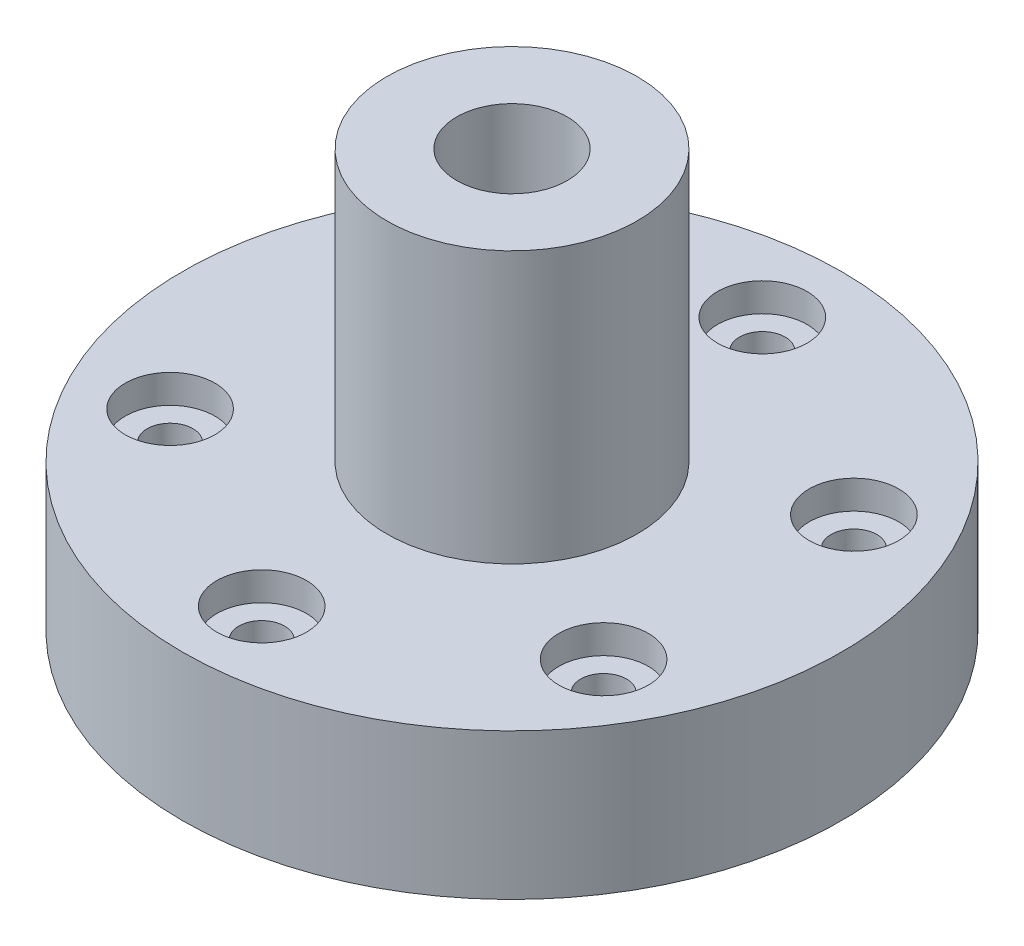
SolidWorks part; units mm, degrees
ref_plane "Front Plane" through (0, 0, 0) normal (0, 0, 1) x (1, 0, 0)
ref_plane "Top Plane" through (0, 0, 0) normal (0, 1, 0) x (1, 0, 0)
ref_plane "Right Plane" through (0, 0, 0) normal (1, 0, 0) x (0, 0, -1)
sketch "Sketch1" plane through (0, 0, 0) normal (0, 0, 1) x (1, 0, 0)
  line L0 (-29, 0) -> (-79, 0)
  line L1 (-79, 0) -> (-79, 35)
  line L2 (-79, 35) -> (-30, 35)
  line L3 (-30, 35) -> (-30, 100)
  line L4 (-29, 0) -> (-29, 20)
  line L5 (-29, 20) -> (0, 20)
  line L6 (0, 20) -> (0, 100)
  line L7 (0, 100) -> (-30, 100)
  dimension "D1" = 79
  dimension "D2" = 50
  dimension "D3" = 20
  dimension "D4" = 35
  dimension "D5" = 100
  dimension "D6" = 30
revolve "Revolve1" add sketch "Sketch1" angle 360 about L6
hole_wizard "M30x3.5 Tapped Hole1" positions "Sketch3" profile "Sketch2" tap size "M30x3.5" standard "Ansi Metric"
sketch "Sketch3" plane through (0, 100, 0) normal (0, 1, 0) x (-1, 0, 0)
  point P0 (0, 0)
sketch "Sketch2" plane through (0, 100, 0) normal (1, 0, 0) x (0, 0, 1)
  line L0 (0, 0) -> (0, 65.4614)
  line L1 (0, 65.4614) -> (13.25, 57.5)
  line L2 (13.25, 57.5) -> (13.25, 0)
  line L5 (13.25, 0) -> (0, 0)
  line L10 (0, 65.4614) -> (-13.25, 57.5) construction
  line L11 (0, -6.35) -> (0, 107.95) construction
  dimension "Tap Drill Dia." = 26.5
  dimension "Tap Drill Depth" = 57.5
  dimension "Drill Angle" = 118
hole_wizard "CBORE for M10 Hex Head Bolt1" positions "Sketch6" profile "Sketch7" counterbore size "M10" standard "Ansi Metric"
sketch "Sketch6" plane through (0, 35, 0) normal (0, 1, 0) x (-1, 0, 0)
  circle A0 centre (0, 0) radius 79 construction
  point P0 (0, -60)
  point P8 (0, -79)
  dimension "D1" = 60
sketch "Sketch7" plane through (0, 35, -60) normal (1, 0, 0) x (0, 0, 1)
  line L0 (0, 0) -> (0, 35)
  line L1 (0, 35) -> (5.5, 35)
  line L3 (5.5, 35) -> (5.5, 6.85)
  line L4 (5.5, 6.85) -> (10.74, 6.85)
  line L5 (10.74, 6.85) -> (10.74, 0)
  line L7 (10.74, 0) -> (0, 0)
  line L11 (0, -6.35) -> (0, 107.95) construction
  dimension "Thru Hole Dia." = 11
  dimension "Thru Hole Depth" = 35
  dimension "C'Bore Dia." = 21.48
  dimension "C'Bore Depth" = 6.85
pattern_circular "CirPattern1" count 6 over 360 about axis through (0, 0, 0) along (0, 1, 0) of "CBORE for M10 Hex Head Bolt1"
